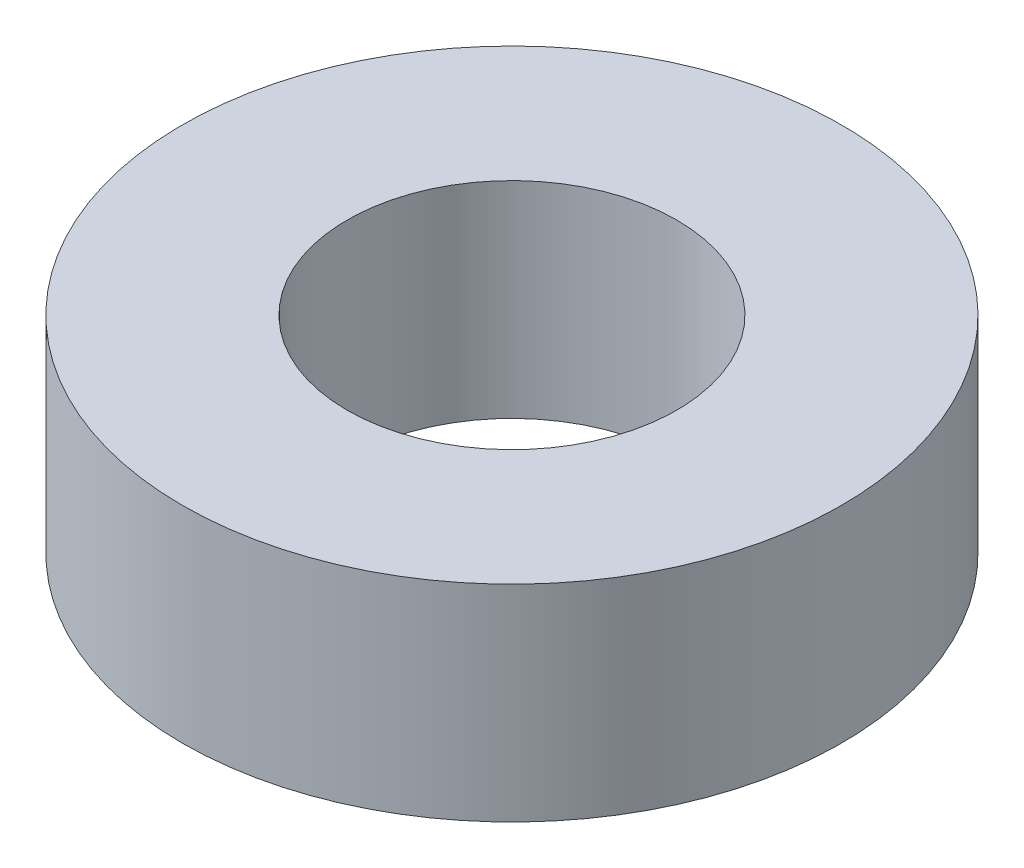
SolidWorks part; units mm, degrees
ref_plane "Front Plane" through (0, 0, 0) normal (0, 0, 1) x (1, 0, 0)
ref_plane "Top Plane" through (0, 0, 0) normal (0, 1, 0) x (1, 0, 0)
ref_plane "Right Plane" through (0, 0, 0) normal (1, 0, 0) x (0, 0, -1)
sketch "Sketch1" plane through (0, 0, 0) normal (0, 1, 0) x (1, 0, 0)
  circle A0 centre (0, 0) radius 2
  circle A1 centre (0, 0) radius 4
  dimension "D1" = 8
  dimension "D2" = 4
extrude "Boss-Extrude1" add sketch "Sketch1" along normal blind 2.5
